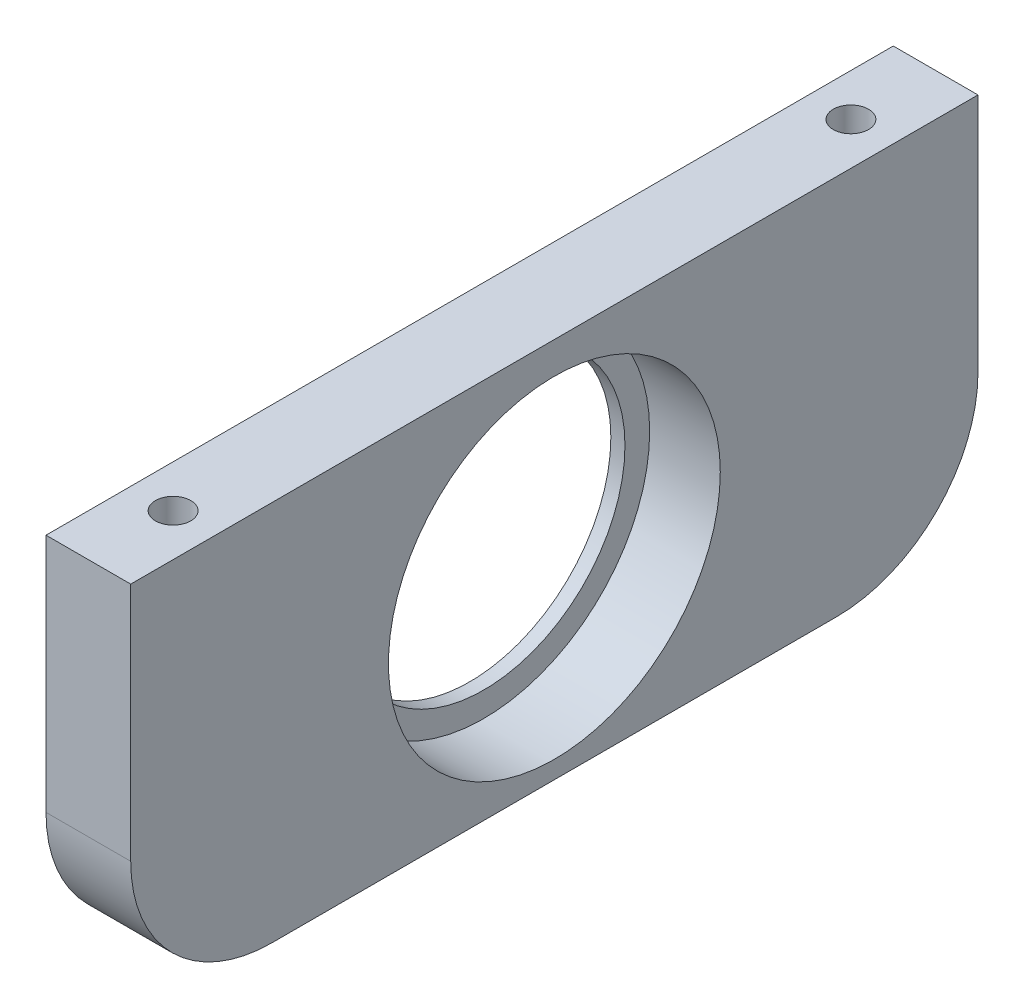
SolidWorks part; units mm, degrees
ref_plane "Front Plane" through (0, 0, 0) normal (0, 0, 1) x (1, 0, 0)
ref_plane "Top Plane" through (0, 0, 0) normal (0, 1, 0) x (1, 0, 0)
ref_plane "Right Plane" through (0, 0, 0) normal (1, 0, 0) x (0, 0, -1)
sketch "Sketch4" plane through (0, 0, 0) normal (1, 0, 0) x (0, 0, -1)
  line L1 (-30, -13) -> (30, -13)
  line L2 (-30, -13) -> (-30, 14)
  line L3 (-30, 14) -> (30, 14)
  line L4 (30, -13) -> (30, 14)
  point P0 (0, 0)
  dimension "D1" = 14
  dimension "D2" = 27
  dimension "D3" = 30
  dimension "D4" = 60
extrude "Boss-Extrude2" add sketch "Sketch4" along normal blind 6
sketch "Sketch5" plane through (6, 0, 0) normal (1, 0, 0) x (0, 0, -1)
  circle A0 centre (0, 0) radius 11.75
  dimension "D1" = 23.5
extrude "Cut-Extrude3" cut sketch "Sketch5" against normal blind 5
sketch "Sketch6" plane through (1, 0, 0) normal (1, 0, 0) x (0, 0, -1)
  circle A0 centre (0, 0) radius 10
  dimension "D1" = 20
extrude "Cut-Extrude4" cut sketch "Sketch6" against normal through all
fillet "Fillet1" radius 10 2 edges at (3, -13, -30) (3, -13, 30)
hole_wizard "M3x0.5 Tapped Hole1" positions "Sketch8" profile "Sketch7" tap size "M3x0.5" standard "ANSI Metric"
sketch "Sketch8" plane through (0, 14, 0) normal (0, 1, 0) x (1, 0, 0)
  line L0 (3, 30) -> (3, 24) construction
  line L1 (6, 30) -> (0, 30) construction
  line L2 (3, 24) -> (3, -24) construction
  line L3 (3, -24) -> (3, -30) construction
  line L4 (6, -30) -> (0, -30) construction
  line L6 (0, -24) -> (3, -24) construction
  line L7 (0, 30) -> (0, -30) construction
  line L8 (3, -24) -> (6, -24) construction
  line L9 (6, 30) -> (6, -30) construction
  point P0 (3, 24)
  point P2 (3, -24)
  dimension "D1" = 6
sketch "Sketch7" plane through (3, 14, -24) normal (1, 0, 0) x (0, 0, 1)
  line L0 (0, 0) -> (0, 8.2511)
  line L1 (0, 8.2511) -> (1.25, 7.5)
  line L2 (1.25, 7.5) -> (1.25, 0)
  line L5 (1.25, 0) -> (0, 0)
  line L10 (0, 8.2511) -> (-1.25, 7.5) construction
  line L11 (0, -6.35) -> (0, 107.95) construction
  dimension "Tap Drill Dia." = 2.5
  dimension "Tap Drill Depth" = 7.5
  dimension "Drill Angle" = 118
